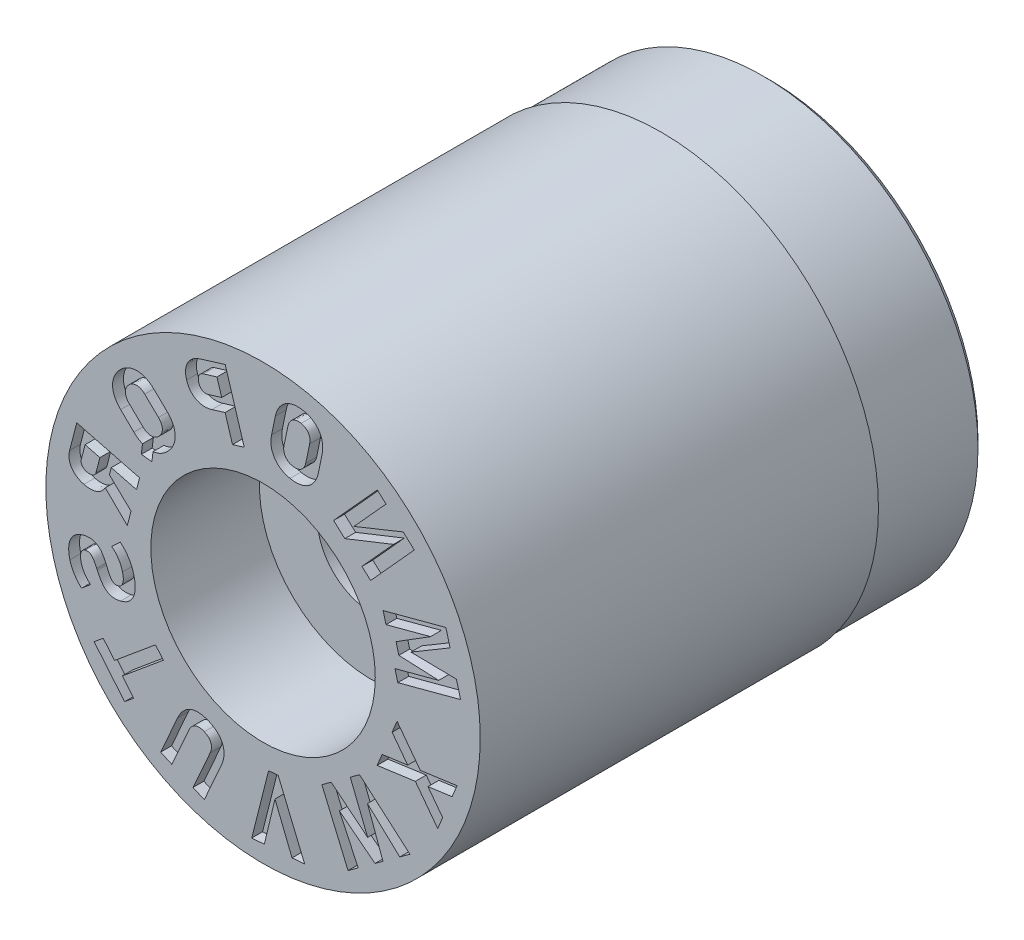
SolidWorks part; units mm, degrees
ref_plane "Front Plane" through (0, 0, 0) normal (0, 0, 1) x (1, 0, 0)
ref_plane "Top Plane" through (0, 0, 0) normal (0, 1, 0) x (1, 0, 0)
ref_plane "Right Plane" through (0, 0, 0) normal (1, 0, 0) x (0, 0, -1)
sketch "Sketch1" plane through (0, 0, 0) normal (1, 0, 0) x (0, 0, -1)
  line L2 (0, 6) -> (0, 3.1)
  line L3 (13.75, 6) -> (0, 6)
  line L4 (-3.7979, 0) -> (49996.2021, 0) construction
  line L8 (14, 1.5) -> (3, 1.5)
  line L9 (3, 3.1) -> (3, 1.5)
  line L10 (3, 3.1) -> (0, 3.1)
  line L12 (14, 1.5) -> (14, 5.75)
  line L16 (14, 5.75) -> (13.75, 6)
  dimension "D1" = 14
  dimension "D2" = 45
  dimension "D3" = 0.25
  dimension "D4" = 12
  dimension "D5" = 6.2
  dimension "D6" = 3
  dimension "D7" = 3
revolve "Revolve1" add sketch "Sketch1" angle 360 about L4
sketch "Sketch4" plane through (0, 0, 0) normal (1, 0, 0) x (0, 0, -1)
  line L0 (0, 0) -> (50000, 0) construction
  line L1 (14, -5.75) -> (14, 5.75) construction
  line L2 (11, 6.935) -> (14, 6.935)
  line L3 (11, 6.935) -> (11, 5.935)
  line L4 (11, 5.935) -> (14, 5.935)
  line L5 (14, 6.935) -> (14, 5.935)
  line L6 (13.75, 6) -> (0, 6) construction
  line L9 (0, 6.6) -> (0, -6.6) construction
  dimension "D1" = 1
  dimension "D2" = 0.065
  dimension "D3" = 11
revolve "Cut-Revolve1" cut sketch "Sketch4" angle 360 about L0
sketch "Sketch5" plane through (0, 0, 0) normal (0, 0, 1) x (1, 0, 0)
  line L0 (5.1654, 1.7444) -> (5.0506, 2.1748)
  line L1 (5.0506, 2.1748) -> (3.3165, 1.7125)
  line L2 (3.3165, 1.7125) -> (3.3958, 1.4158)
  line L3 (3.3958, 1.4158) -> (4.6273, 1.744)
  line L4 (-1.0446, 5.4175) -> (-1.3682, 5.3187)
  line L5 (4.6273, 1.744) -> (3.6742, 1.1476)
  line L6 (3.6742, 1.1476) -> (3.7511, 0.8588)
  line L7 (3.7511, 0.8588) -> (4.8515, 0.8098)
  line L9 (4.8515, 0.8098) -> (3.643, 0.4877)
  line L10 (3.643, 0.4877) -> (3.7221, 0.1908)
  line L11 (3.7221, 0.1908) -> (5.4563, 0.6531)
  line L12 (5.4563, 0.6531) -> (5.3418, 1.0836)
  line L13 (5.3418, 1.0836) -> (4.0848, 1.1025)
  line L14 (4.0848, 1.1025) -> (5.1654, 1.7444)
  line L15 (4.1787, 3.5924) -> (3.8713, 3.8709)
  line L16 (3.8713, 3.8709) -> (2.5124, 3.3232)
  line L18 (2.5124, 3.3232) -> (3.3969, 4.3002)
  line L19 (3.3969, 4.3002) -> (3.1564, 4.5178)
  line L20 (3.1564, 4.5178) -> (1.9495, 3.1846)
  line L21 (1.9495, 3.1846) -> (2.2588, 2.9048)
  line L22 (2.2588, 2.9048) -> (3.6023, 3.4386)
  line L24 (3.6023, 3.4386) -> (2.7316, 2.4768)
  line L25 (2.7316, 2.4768) -> (2.9718, 2.2591)
  line L26 (2.9718, 2.2591) -> (4.1787, 3.5924)
  line L27 (1.5262, 4.1053) -> (1.631, 4.606)
  line L28 (0.3404, 4.8755) -> (0.2356, 4.3748)
  line L29 (0.5792, 4.2943) -> (0.6873, 4.8119)
  line L30 (1.2878, 4.6863) -> (1.1796, 4.1687)
  line L31 (-1.1424, 4.5795) -> (-1.5157, 4.4657)
  line L32 (-1.6462, 4.8931) -> (-1.273, 5.0069)
  line L33 (-1.0472, 4.2678) -> (-0.8439, 3.602)
  line L34 (-1.3682, 5.3187) -> (-1.7332, 5.2073)
  line L35 (-1.4121, 4.1564) -> (-1.0472, 4.2678)
  line L36 (-4.1925, 1.3779) -> (-3.495, 1.197)
  line L37 (-4.1027, -3.1917) -> (-4.4157, -2.8153)
  line L38 (-1.273, 5.0069) -> (-1.1424, 4.5795)
  line L39 (-0.8439, 3.602) -> (-0.5202, 3.7007)
  line L40 (-0.5202, 3.7007) -> (-1.0446, 5.4175)
  line L42 (-3.3297, 2.3797) -> (-3.3625, 2.1101)
  line L43 (-3.3625, 2.1101) -> (-3.0704, 2.0795)
  line L44 (-3.0704, 2.0795) -> (-3.0394, 2.3364)
  line L45 (-2.6491, 3.4882) -> (-3.0167, 3.8444)
  line L46 (-3.9352, 2.8958) -> (-3.5677, 2.5396)
  line L47 (-3.3154, 2.7877) -> (-3.6958, 3.156)
  line L48 (-3.2686, 3.5971) -> (-2.8882, 3.2288)
  line L49 (-4.5074, 1.4596) -> (-4.613, 1.0531)
  line L50 (-5.0209, 1.1591) -> (-4.9154, 1.5654)
  line L53 (-4.2439, 1.1799) -> (-4.1925, 1.3779)
  line L55 (-5.1457, 1.9741) -> (-5.3424, 1.2145)
  line L56 (-4.9154, 1.5654) -> (-4.5074, 1.4596)
  line L57 (-3.495, 1.197) -> (-3.4105, 1.5241)
  line L58 (-3.4105, 1.5241) -> (-5.1457, 1.9741)
  line L60 (-4.3576, 0.8121) -> (-3.7505, 0.2122)
  line L61 (-3.7505, 0.2122) -> (-3.6477, 0.6081)
  line L62 (-3.6477, 0.6081) -> (-4.2439, 1.1799)
  line L63 (-3.9475, -0.2813) -> (-4.1817, -0.5018)
  line L64 (-4.007, -1.3562) -> (-4.0085, -1.3565)
  line L65 (-4.2963, -1.0879) -> (-4.3065, -1.0626)
  line L66 (-4.9585, -0.6215) -> (-4.96, -0.6219)
  line L67 (-5.0124, -1.9173) -> (-4.768, -1.708)
  line L68 (-4.9093, -0.9572) -> (-4.9081, -0.957)
  line L69 (-3.9338, -1.6853) -> (-3.9317, -1.6846)
  line L71 (-3.8861, -3.4523) -> (-2.7544, -2.5113)
  line L72 (-2.7544, -2.5113) -> (-2.9711, -2.2507)
  line L73 (-2.9711, -2.2507) -> (-4.1027, -3.1917)
  line L74 (-4.6665, -3.0237) -> (-3.8238, -4.0373)
  line L75 (-3.8238, -4.0373) -> (-3.573, -3.8289)
  line L76 (-3.573, -3.8289) -> (-3.8861, -3.4523)
  line L77 (-4.4157, -2.8153) -> (-4.6665, -3.0237)
  line L78 (-2.3599, -3.694) -> (-2.829, -4.747)
  line L79 (-2.829, -4.747) -> (-2.5181, -4.8857)
  line L80 (-2.5181, -4.8857) -> (-2.0455, -3.8251)
  line L81 (-1.4622, -4.0848) -> (-1.9349, -5.1454)
  line L82 (-1.9349, -5.1454) -> (-1.6237, -5.2839)
  line L83 (-1.6237, -5.2839) -> (-1.1546, -4.2308)
  line L84 (-0.3134, -5.5446) -> (0.0358, -5.5187)
  line L85 (0.0358, -5.5187) -> (0.3298, -4.2898)
  line L86 (0.3298, -4.2898) -> (0.8007, -5.4626)
  line L87 (0.8007, -5.4626) -> (1.15, -5.4368)
  line L88 (1.15, -5.4368) -> (0.4187, -3.6808)
  line L89 (0.4187, -3.6808) -> (0.1534, -3.7001)
  line L90 (0.1534, -3.7001) -> (-0.3134, -5.5446)
  line L91 (3.093, -4.4494) -> (3.3124, -4.2895)
  line L92 (3.3124, -4.2895) -> (2.8847, -3.1197)
  line L93 (2.8847, -3.1197) -> (3.7763, -3.9516)
  line L94 (3.7763, -3.9516) -> (4.0577, -3.7465)
  line L95 (4.0577, -3.7465) -> (2.6667, -2.5395)
  line L96 (2.6667, -2.5395) -> (2.4092, -2.7268)
  line L97 (2.4092, -2.7268) -> (2.89, -3.9279)
  line L98 (2.89, -3.9279) -> (1.8824, -3.1107)
  line L99 (1.8824, -3.1107) -> (1.6252, -3.2982)
  line L100 (1.6252, -3.2982) -> (2.3478, -4.9924)
  line L101 (2.3478, -4.9924) -> (2.6291, -4.7873)
  line L102 (2.6291, -4.7873) -> (2.1104, -3.6838)
  line L103 (2.1104, -3.6838) -> (3.093, -4.4494)
  line L105 (4.2076, -1.9277) -> (4.8249, -2.7493)
  line L106 (4.8249, -2.7493) -> (4.9619, -2.418)
  line L107 (4.9619, -2.418) -> (4.5565, -1.8793)
  line L109 (4.3437, -1.5968) -> (3.7022, -0.7417)
  line L110 (3.7022, -0.7417) -> (3.5655, -1.0733)
  line L111 (3.5655, -1.0733) -> (3.9952, -1.6451)
  line L112 (4.5565, -1.8793) -> (5.2224, -1.7875)
  line L113 (5.2224, -1.7875) -> (5.3597, -1.4559)
  line L114 (5.3597, -1.4559) -> (4.3437, -1.5968)
  line L115 (3.9952, -1.6451) -> (3.2887, -1.743)
  line L116 (3.2887, -1.743) -> (3.1517, -2.0743)
  line L117 (3.1517, -2.0743) -> (4.2076, -1.9277)
  circle A0 centre (0, 0) radius 3.7731 construction
  spline S0 degree 3 poles (0.7447, 3.5886) (0.7759, 3.5826) (0.8224, 3.5747) (0.8845, 3.5709) (0.9294, 3.571) (0.9735, 3.5732) (1.0167, 3.5788) (1.059, 3.5872) (1.1003, 3.5984) (1.1403, 3.612) (1.1787, 3.6286) (1.2156, 3.6473) (1.2506, 3.6691) (1.2844, 3.6927) (1.3163, 3.7193) (1.3468, 3.7482) (1.3752, 3.7798) (1.402, 3.8133) (1.4265, 3.8492) (1.4485, 3.8872) (1.4688, 3.9268) (1.4866, 3.9686) (1.5073, 4.0277) (1.5199, 4.0737) (1.5262, 4.1053) knots 0 0 0 0 0.090309 0.133955 0.17644 0.218092 0.259396 0.30008 0.340623 0.380716 0.420299 0.459324 0.498272 0.537251 0.576572 0.616137 0.656469 0.6971 0.738132 0.779773 0.821894 0.864642 0.908542 1 1 1 1
  spline S1 degree 3 poles (1.631, 4.606) (1.6372, 4.6375) (1.6452, 4.6845) (1.6492, 4.7472) (1.6495, 4.7926) (1.6474, 4.8372) (1.6419, 4.8806) (1.6341, 4.9233) (1.6229, 4.9647) (1.6094, 5.005) (1.5935, 5.0439) (1.5748, 5.081) (1.5533, 5.1162) (1.5299, 5.15) (1.5035, 5.1818) (1.475, 5.2124) (1.4437, 5.2408) (1.4104, 5.2674) (1.3751, 5.2921) (1.3376, 5.3145) (1.2982, 5.3344) (1.257, 5.3525) (1.1986, 5.3736) (1.1529, 5.3854) (1.1218, 5.3918) knots 0 0 0 0 0.091337 0.135318 0.17845 0.220422 0.262032 0.302814 0.343637 0.383994 0.423573 0.462827 0.501982 0.540672 0.579691 0.6194 0.659411 0.699714 0.74048 0.781827 0.823609 0.866016 0.909555 1 1 1 1
  spline S2 degree 3 poles (1.1218, 5.3918) (1.0907, 5.3987) (1.0441, 5.4053) (0.9822, 5.4098) (0.9374, 5.4098) (0.8933, 5.4073) (0.8502, 5.4018) (0.8079, 5.3933) (0.7667, 5.3822) (0.7266, 5.3685) (0.6882, 5.3521) (0.6514, 5.3331) (0.6159, 5.3123) (0.5827, 5.2877) (0.5505, 5.2614) (0.5202, 5.2324) (0.4918, 5.2008) (0.4649, 5.1673) (0.4406, 5.1313) (0.418, 5.0937) (0.3979, 5.054) (0.38, 5.0123) (0.3593, 4.953) (0.3467, 4.907) (0.3404, 4.8755) knots 0 0 0 0 0.090358 0.133573 0.176392 0.217748 0.259065 0.299764 0.340321 0.380426 0.420023 0.459061 0.497939 0.537051 0.576386 0.615964 0.656311 0.696955 0.738001 0.779698 0.821486 0.864596 0.908511 1 1 1 1
  spline S3 degree 3 poles (0.2356, 4.3748) (0.2294, 4.3433) (0.2213, 4.2963) (0.2174, 4.2336) (0.217, 4.1881) (0.2198, 4.1436) (0.2245, 4.1) (0.233, 4.0574) (0.244, 4.0159) (0.2574, 3.9756) (0.2737, 3.937) (0.2923, 3.9001) (0.3134, 3.8646) (0.3374, 3.8311) (0.3631, 3.7987) (0.3923, 3.7686) (0.4231, 3.7397) (0.4566, 3.7133) (0.4918, 3.6885) (0.5292, 3.6662) (0.5686, 3.6463) (0.6097, 3.6282) (0.6681, 3.6072) (0.7136, 3.5954) (0.7447, 3.5886) knots 0 0 0 0 0.091366 0.135362 0.178507 0.220649 0.262097 0.303088 0.343924 0.384295 0.423646 0.462912 0.501797 0.540796 0.579987 0.619572 0.65971 0.700026 0.740805 0.782165 0.823614 0.866382 0.909588 1 1 1 1
  spline S4 degree 3 poles (0.8146, 3.9216) (0.7863, 3.9278) (0.7451, 3.9403) (0.6964, 3.9679) (0.6641, 3.9918) (0.6366, 4.02) (0.613, 4.0512) (0.5949, 4.086) (0.5812, 4.1237) (0.5729, 4.1638) (0.568, 4.2212) (0.5732, 4.2651) (0.5792, 4.2943) knots 0 0 0 0 0.175337 0.256981 0.337413 0.416956 0.494362 0.572678 0.653127 0.735718 0.819651 1 1 1 1
  spline S5 degree 3 poles (0.6873, 4.8119) (0.694, 4.8408) (0.7058, 4.8835) (0.7338, 4.9338) (0.7573, 4.9674) (0.7849, 4.9963) (0.8156, 5.0207) (0.8494, 5.0403) (0.8862, 5.0545) (0.9252, 5.064) (0.9811, 5.0692) (1.0238, 5.0648) (1.0522, 5.0587) knots 0 0 0 0 0.179938 0.264469 0.346756 0.426904 0.50555 0.582668 0.66206 0.742723 0.824728 1 1 1 1
  spline S6 degree 3 poles (1.0522, 5.0587) (1.0807, 5.0529) (1.1218, 5.0401) (1.1709, 5.0128) (1.2027, 4.9883) (1.2305, 4.9606) (1.2539, 4.9294) (1.2721, 4.8946) (1.2858, 4.8569) (1.294, 4.8168) (1.2989, 4.7594) (1.2937, 4.7155) (1.2878, 4.6863) knots 0 0 0 0 0.175431 0.257806 0.338407 0.416987 0.494388 0.5727 0.653145 0.735732 0.819661 1 1 1 1
  spline S7 degree 3 poles (1.1796, 4.1687) (1.1734, 4.1396) (1.1603, 4.0975) (1.1333, 4.0467) (1.1096, 4.0133) (1.0821, 3.9843) (1.0512, 3.9602) (1.0177, 3.9404) (0.981, 3.9259) (0.9419, 3.9164) (0.8859, 3.9116) (0.843, 3.9156) (0.8146, 3.9216) knots 0 0 0 0 0.179869 0.264322 0.346594 0.426726 0.504705 0.582404 0.66126 0.741908 0.824543 1 1 1 1
  spline S8 degree 3 poles (-1.5157, 4.4657) (-1.534, 4.4604) (-1.5619, 4.4545) (-1.5992, 4.4557) (-1.6259, 4.4604) (-1.6514, 4.4686) (-1.6753, 4.481) (-1.6976, 4.4962) (-1.7182, 4.5149) (-1.7368, 4.5367) (-1.7589, 4.5703) (-1.7699, 4.5991) (-1.7763, 4.6187) knots 0 0 0 0 0.169096 0.248837 0.328291 0.407592 0.485444 0.56448 0.645699 0.730517 0.816943 1 1 1 1
  spline S9 degree 3 poles (-1.7763, 4.6187) (-1.7821, 4.6388) (-1.7891, 4.6692) (-1.7897, 4.7097) (-1.7868, 4.7383) (-1.7809, 4.7656) (-1.771, 4.7909) (-1.7582, 4.8145) (-1.7413, 4.8353) (-1.7221, 4.8543) (-1.6913, 4.8761) (-1.6647, 4.8872) (-1.6462, 4.8931) knots 0 0 0 0 0.184004 0.27093 0.354752 0.435986 0.514589 0.592825 0.670551 0.749073 0.829595 1 1 1 1
  spline S10 degree 3 poles (-1.7332, 5.2073) (-1.784, 5.1922) (-1.8563, 5.1617) (-1.9416, 5.1052) (-1.9965, 5.0571) (-2.0436, 5.0033) (-2.0816, 4.9443) (-2.1111, 4.8807) (-2.1306, 4.8127) (-2.1414, 4.7415) (-2.1424, 4.6412) (-2.1268, 4.5659) (-2.112, 4.5163) knots 0 0 0 0 0.179249 0.263208 0.345337 0.425394 0.504137 0.58209 0.661679 0.742471 0.824841 1 1 1 1
  spline S11 degree 3 poles (-2.112, 4.5163) (-2.0969, 4.4667) (-2.0669, 4.3958) (-2.0102, 4.3129) (-1.9615, 4.26) (-1.9074, 4.2147) (-1.8477, 4.1786) (-1.7831, 4.1513) (-1.7142, 4.1333) (-1.6419, 4.1243) (-1.5396, 4.1253) (-1.4627, 4.1409) (-1.4121, 4.1564) knots 0 0 0 0 0.175848 0.258225 0.33901 0.418386 0.496357 0.574428 0.654799 0.736649 0.820571 1 1 1 1
  spline S12 degree 3 poles (-2.6292, 2.5504) (-2.607, 2.5733) (-2.5762, 2.609) (-2.5393, 2.6589) (-2.5152, 2.6969) (-2.4942, 2.7359) (-2.4755, 2.7753) (-2.46, 2.8156) (-2.4473, 2.8565) (-2.4379, 2.8977) (-2.4308, 2.9389) (-2.4278, 2.9802) (-2.4266, 3.0215) (-2.4293, 3.0628) (-2.4347, 3.1041) (-2.4431, 3.1452) (-2.4544, 3.1863) (-2.4685, 3.2269) (-2.4857, 3.2668) (-2.5058, 3.3059) (-2.5288, 3.3441) (-2.5547, 3.3813) (-2.5932, 3.431) (-2.626, 3.4658) (-2.6491, 3.4882) knots 0 0 0 0 0.090426 0.133689 0.176148 0.218001 0.259295 0.300043 0.340441 0.380689 0.419969 0.459108 0.498041 0.53728 0.576345 0.61612 0.656449 0.697181 0.738178 0.779637 0.821748 0.864691 0.908434 1 1 1 1
  spline S13 degree 3 poles (-3.0167, 3.8444) (-3.0395, 3.8672) (-3.0759, 3.8982) (-3.1267, 3.9352) (-3.1648, 3.9602) (-3.204, 3.9816) (-3.2435, 4.0006) (-3.2839, 4.0166) (-3.325, 4.0294) (-3.3664, 4.0395) (-3.4078, 4.0465) (-3.4493, 4.0509) (-3.4906, 4.0514) (-3.5319, 4.0499) (-3.5731, 4.0446) (-3.6142, 4.0368) (-3.655, 4.0258) (-3.6954, 4.012) (-3.735, 3.9948) (-3.7739, 3.9751) (-3.8119, 3.9525) (-3.8492, 3.9274) (-3.8978, 3.8887) (-3.9329, 3.8572) (-3.9548, 3.834) knots 0 0 0 0 0.091403 0.135417 0.178547 0.220567 0.262012 0.302889 0.34372 0.384051 0.423731 0.462948 0.50222 0.541091 0.580115 0.619826 0.659729 0.700018 0.741007 0.781995 0.823929 0.866198 0.909652 1 1 1 1
  spline S14 degree 3 poles (-3.9548, 3.834) (-3.977, 3.8112) (-4.0077, 3.7754) (-4.0448, 3.7255) (-4.0686, 3.6873) (-4.0899, 3.6485) (-4.1084, 3.6091) (-4.124, 3.5688) (-4.1367, 3.528) (-4.146, 3.4867) (-4.1536, 3.4455) (-4.1565, 3.4041) (-4.1578, 3.3628) (-4.1549, 3.3215) (-4.1503, 3.2803) (-4.1411, 3.2392) (-4.13, 3.1981) (-4.1158, 3.1575) (-4.0987, 3.1176) (-4.0784, 3.0785) (-4.0557, 3.04) (-4.0296, 3.0027) (-3.9912, 2.953) (-3.9584, 2.9183) (-3.9352, 2.8958) knots 0 0 0 0 0.090391 0.133637 0.176367 0.217904 0.259183 0.299915 0.340297 0.38053 0.419864 0.458987 0.498252 0.537129 0.576146 0.615965 0.656278 0.696994 0.737976 0.779419 0.821817 0.864744 0.90847 1 1 1 1
  spline S15 degree 3 poles (-3.5677, 2.5396) (-3.5449, 2.5169) (-3.5085, 2.4858) (-3.4576, 2.449) (-3.4198, 2.4237) (-3.3805, 2.4025) (-3.3503, 2.3884) (-3.3333, 2.3812) (-3.3297, 2.3797) knots 0 0 0 0 0.091394 0.135404 0.178246 0.220561 0.261843 0.272833 0.272833 0.272833 0.272833
  spline S16 degree 3 poles (-2.8738, 2.7874) (-2.894, 2.7663) (-2.927, 2.7387) (-2.9766, 2.7119) (-3.0142, 2.6979) (-3.0527, 2.6891) (-3.0918, 2.6863) (-3.1309, 2.6895) (-3.1699, 2.6983) (-3.2086, 2.7123) (-3.2593, 2.7398) (-3.2941, 2.7668) (-3.3154, 2.7877) knots 0 0 0 0 0.175986 0.257432 0.338339 0.41715 0.495361 0.573284 0.653221 0.73592 0.820149 1 1 1 1
  spline S17 degree 3 poles (-3.6958, 3.156) (-3.7171, 3.177) (-3.7459, 3.2105) (-3.7746, 3.2606) (-3.7896, 3.2987) (-3.8, 3.3373) (-3.8043, 3.3763) (-3.8027, 3.4153) (-3.7949, 3.454) (-3.7824, 3.4923) (-3.7565, 3.5423) (-3.7299, 3.5761) (-3.7098, 3.5971) knots 0 0 0 0 0.180529 0.264653 0.347008 0.427165 0.50483 0.582495 0.661932 0.742211 0.824735 1 1 1 1
  spline S18 degree 3 poles (-3.7098, 3.5971) (-3.6899, 3.6183) (-3.6566, 3.6452) (-3.6075, 3.6726) (-3.5698, 3.6865) (-3.5314, 3.6954) (-3.4924, 3.698) (-3.4532, 3.6954) (-3.4141, 3.6866) (-3.3758, 3.6722) (-3.3244, 3.6459) (-3.2902, 3.6177) (-3.2686, 3.5971) knots 0 0 0 0 0.175091 0.256927 0.337894 0.416762 0.494294 0.572927 0.652923 0.734998 0.819566 1 1 1 1
  spline S19 degree 3 poles (-2.8882, 3.2288) (-2.8668, 3.2081) (-2.8381, 3.1746) (-2.8094, 3.1246) (-2.7942, 3.0864) (-2.7845, 3.0475) (-2.78, 3.0083) (-2.7818, 2.9692) (-2.789, 2.9304) (-2.8016, 2.8921) (-2.8276, 2.8424) (-2.8531, 2.8078) (-2.8738, 2.7874) knots 0 0 0 0 0.179935 0.264042 0.346381 0.427082 0.505467 0.583116 0.662376 0.742638 0.825146 1 1 1 1
  spline S20 degree 3 poles (-4.613, 1.0531) (-4.6174, 1.0374) (-4.6255, 1.0143) (-4.6443, 0.9883) (-4.6606, 0.9713) (-4.6791, 0.9568) (-4.7001, 0.9453) (-4.7229, 0.9362) (-4.7479, 0.9307) (-4.7745, 0.9278) (-4.8126, 0.9277) (-4.8414, 0.9328) (-4.8608, 0.9371) knots 0 0 0 0 0.159483 0.236468 0.311878 0.3885 0.46582 0.544822 0.628637 0.715237 0.805714 1 1 1 1
  spline S21 degree 3 poles (-4.8608, 0.9371) (-4.8802, 0.9417) (-4.9075, 0.9517) (-4.9411, 0.9694) (-4.9626, 0.9851) (-4.9821, 1.0017) (-4.9976, 1.0207) (-5.0105, 1.041) (-5.0194, 1.0628) (-5.0256, 1.0856) (-5.0281, 1.1181) (-5.0255, 1.1428) (-5.0209, 1.1591) knots 0 0 0 0 0.19339 0.282662 0.368882 0.451761 0.530888 0.607069 0.684211 0.759973 0.836229 1 1 1 1
  spline S22 degree 3 poles (-5.3424, 1.2145) (-5.3543, 1.1693) (-5.3642, 1.1007) (-5.3589, 1.0102) (-5.3452, 0.9462) (-5.3229, 0.8856) (-5.292, 0.8289) (-5.253, 0.7767) (-5.2057, 0.7295) (-5.1514, 0.6874) (-5.0672, 0.6386) (-4.9971, 0.6128) (-4.948, 0.6006) knots 0 0 0 0 0.170567 0.250705 0.330137 0.408355 0.486027 0.564778 0.645617 0.729164 0.815362 1 1 1 1
  spline S23 degree 3 poles (-4.948, 0.6006) (-4.8993, 0.588) (-4.8257, 0.5753) (-4.7287, 0.5778) (-4.6606, 0.5877) (-4.5964, 0.6061) (-4.5368, 0.6328) (-4.4822, 0.6675) (-4.4333, 0.7103) (-4.391, 0.7585) (-4.3678, 0.7941) (-4.3576, 0.8121) knots 0 0 0 0 0.184092 0.270177 0.353603 0.434757 0.513264 0.591389 0.670213 0.749653 0.825011 0.825011 0.825011 0.825011
  spline S24 degree 3 poles (-3.5671, -0.8858) (-3.5776, -0.8446) (-3.5956, -0.7832) (-3.6273, -0.7045) (-3.6531, -0.647) (-3.6818, -0.5916) (-3.7128, -0.5385) (-3.7467, -0.4881) (-3.7829, -0.4403) (-3.8212, -0.3957) (-3.874, -0.3405) (-3.9172, -0.3035) (-3.9475, -0.2813) knots 0 0 0 0 0.175644 0.262832 0.349669 0.435327 0.519542 0.603115 0.685284 0.766329 0.845433 1 1 1 1
  spline S25 degree 3 poles (-4.1817, -0.5018) (-4.1453, -0.5287) (-4.0947, -0.575) (-4.0352, -0.6453) (-3.9946, -0.7033) (-3.9582, -0.7646) (-3.9164, -0.8503) (-3.894, -0.9184) (-3.8821, -0.9645) knots 0 0 0 0 0.24138 0.364999 0.491375 0.618869 0.745657 1 1 1 1
  spline S26 degree 3 poles (-3.8821, -0.9645) (-3.876, -0.9899) (-3.8679, -1.0272) (-3.8621, -1.0763) (-3.8594, -1.1102) (-3.8602, -1.1424) (-3.8624, -1.1727) (-3.8673, -1.2012) (-3.8743, -1.2278) (-3.8833, -1.2524) (-3.8947, -1.2746) (-3.9082, -1.2945) (-3.9236, -1.3121) (-3.9415, -1.3269) (-3.9687, -1.3435) (-3.9913, -1.3521) (-4.007, -1.3562) knots 0 0 0 0 0.170587 0.248328 0.322569 0.391806 0.45816 0.52068 0.580488 0.636971 0.691385 0.742745 0.792954 0.843465 0.8938 1 1 1 1
  spline S27 degree 3 poles (-4.0085, -1.3565) (-4.0296, -1.3622) (-4.0616, -1.365) (-4.1025, -1.3573) (-4.1294, -1.3449) (-4.1538, -1.3278) (-4.1764, -1.3072) (-4.1971, -1.2831) (-4.2161, -1.2551) (-4.2336, -1.2226) (-4.2598, -1.1714) (-4.2782, -1.1299) (-4.2908, -1.1007) knots 0 0 0 0 0.155114 0.225021 0.294521 0.364238 0.436403 0.511397 0.59025 0.676475 0.774019 1 1 1 1
  spline S28 degree 3 poles (-4.2908, -1.1007) (-4.2917, -1.0986) (-4.2934, -1.0943) (-4.295, -1.0899) (-4.2963, -1.0879) knots 0 0 0 0 0.500653 1 1 1 1
  spline S29 degree 3 poles (-4.3065, -1.0626) (-4.3283, -1.0107) (-4.3624, -0.9374) (-4.4112, -0.8467) (-4.4468, -0.7892) (-4.4854, -0.738) (-4.5315, -0.6946) (-4.5841, -0.6575) (-4.6329, -0.6321) (-4.6754, -0.616) (-4.7099, -0.6073) (-4.7463, -0.6012) (-4.7848, -0.5989) (-4.8254, -0.5996) (-4.8839, -0.6054) (-4.9285, -0.6139) (-4.9585, -0.6215) knots 0 0 0 0 0.19047 0.273753 0.348938 0.419574 0.490325 0.562218 0.637266 0.676009 0.715892 0.757574 0.800922 0.846505 0.89498 1 1 1 1
  spline S30 degree 3 poles (-4.96, -0.6219) (-4.9873, -0.6285) (-5.027, -0.6412) (-5.0772, -0.6622) (-5.1123, -0.6795) (-5.1453, -0.6991) (-5.176, -0.7209) (-5.2047, -0.7444) (-5.2313, -0.7697) (-5.2554, -0.7972) (-5.2772, -0.8264) (-5.2975, -0.8568) (-5.3142, -0.8895) (-5.3295, -0.9235) (-5.3419, -0.9595) (-5.3524, -0.997) (-5.3602, -1.0362) (-5.3654, -1.077) (-5.369, -1.1191) (-5.3694, -1.1627) (-5.3674, -1.2078) (-5.3631, -1.2541) (-5.3541, -1.319) (-5.3437, -1.3679) (-5.3356, -1.4008) knots 0 0 0 0 0.086007 0.12694 0.166595 0.205532 0.243984 0.281754 0.319047 0.356206 0.393347 0.430504 0.467637 0.505717 0.544356 0.584034 0.624686 0.666506 0.709556 0.753906 0.799904 0.84734 0.896318 1 1 1 1
  spline S31 degree 3 poles (-5.3356, -1.4008) (-5.3272, -1.4324) (-5.3132, -1.48) (-5.2878, -1.5414) (-5.2595, -1.6037) (-5.2163, -1.6788) (-5.1373, -1.7941) (-5.0649, -1.8709) (-5.0124, -1.9173) knots 0 0 0 0 0.158912 0.240043 0.322666 0.490655 0.659732 1 1 1 1
  spline S32 degree 3 poles (-4.768, -1.708) (-4.7989, -1.6805) (-4.8432, -1.6371) (-4.8947, -1.5734) (-4.9295, -1.5245) (-4.96, -1.4746) (-4.993, -1.4083) (-5.0114, -1.3569) (-5.0201, -1.3223) knots 0 0 0 0 0.265982 0.396334 0.525301 0.651055 0.771158 1 1 1 1
  spline S33 degree 3 poles (-5.0201, -1.3223) (-5.026, -1.2984) (-5.0336, -1.2633) (-5.039, -1.2171) (-5.0419, -1.1852) (-5.0414, -1.155) (-5.0397, -1.1267) (-5.0358, -1.1) (-5.0296, -1.0753) (-5.0214, -1.0524) (-5.011, -1.0319) (-4.999, -1.0136) (-4.9846, -0.9977) (-4.9689, -0.9836) (-4.9441, -0.9686) (-4.9238, -0.9603) (-4.9093, -0.9572) knots 0 0 0 0 0.173025 0.252201 0.327257 0.39764 0.464425 0.526485 0.586732 0.643338 0.696996 0.74776 0.797256 0.84667 0.895785 1 1 1 1
  spline S34 degree 3 poles (-4.9081, -0.957) (-4.8852, -0.9518) (-4.8503, -0.9468) (-4.806, -0.956) (-4.777, -0.9696) (-4.7512, -0.988) (-4.7266, -1.0089) (-4.7054, -1.0339) (-4.6856, -1.0625) (-4.6661, -1.0959) (-4.636, -1.1516) (-4.6141, -1.1975) (-4.5985, -1.2299) knots 0 0 0 0 0.156351 0.226805 0.295873 0.365882 0.435858 0.507883 0.58184 0.665041 0.762672 1 1 1 1
  spline S35 degree 3 poles (-4.5985, -1.2299) (-4.5964, -1.2326) (-4.5949, -1.2392) (-4.5916, -1.2452) (-4.59, -1.2482) knots 0 0 0 0 0.492003 1 1 1 1
  spline S36 degree 3 poles (-4.59, -1.2482) (-4.5881, -1.2527) (-4.5835, -1.2613) (-4.5788, -1.2699) (-4.5769, -1.2745) knots 0 0 0 0 0.499993 1 1 1 1
  spline S37 degree 3 poles (-4.5769, -1.2745) (-4.5544, -1.3232) (-4.5191, -1.3923) (-4.4679, -1.4772) (-4.4307, -1.5318) (-4.3901, -1.5797) (-4.3436, -1.6204) (-4.2913, -1.6545) (-4.2436, -1.6779) (-4.2023, -1.692) (-4.169, -1.6999) (-4.134, -1.7048) (-4.0972, -1.7071) (-4.0588, -1.7059) (-4.0037, -1.7008) (-3.9621, -1.6919) (-3.9338, -1.6853) knots 0 0 0 0 0.189359 0.273145 0.349573 0.422066 0.493982 0.566732 0.641676 0.680723 0.720434 0.762091 0.805057 0.850373 0.897539 1 1 1 1
  spline S38 degree 3 poles (-3.9317, -1.6846) (-3.9048, -1.6779) (-3.8654, -1.6661) (-3.8158, -1.6446) (-3.781, -1.6273) (-3.749, -1.6069) (-3.7183, -1.5857) (-3.6906, -1.5614) (-3.6643, -1.5356) (-3.6406, -1.5076) (-3.6192, -1.4777) (-3.5998, -1.4463) (-3.5828, -1.4131) (-3.5686, -1.3778) (-3.5569, -1.3408) (-3.5469, -1.3021) (-3.5394, -1.2616) (-3.5345, -1.2195) (-3.5317, -1.1759) (-3.5318, -1.131) (-3.5332, -1.0845) (-3.5387, -1.0368) (-3.5479, -0.9701) (-3.5588, -0.9198) (-3.5671, -0.8858) knots 0 0 0 0 0.083718 0.12368 0.162774 0.200841 0.238026 0.275062 0.312041 0.348948 0.385557 0.422743 0.460081 0.49804 0.537154 0.577089 0.618552 0.661206 0.704906 0.75011 0.796783 0.84492 0.894727 1 1 1 1
  spline S39 degree 3 poles (-1.4848, -3.3485) (-1.5156, -3.335) (-1.5617, -3.3168) (-1.624, -3.2983) (-1.6692, -3.2876) (-1.7137, -3.2797) (-1.7575, -3.275) (-1.8005, -3.2736) (-1.8427, -3.2749) (-1.8838, -3.2795) (-1.9241, -3.2868) (-1.9633, -3.2968) (-2.0012, -3.3103) (-2.0382, -3.3266) (-2.0739, -3.3461) (-2.1086, -3.3683) (-2.142, -3.3935) (-2.1742, -3.4216) (-2.2051, -3.4524) (-2.2346, -3.4859) (-2.2626, -3.5221) (-2.2895, -3.561) (-2.3231, -3.6179) (-2.3464, -3.6626) (-2.3599, -3.694) knots 0 0 0 0 0.094156 0.138779 0.182139 0.22438 0.265402 0.305403 0.344817 0.38363 0.421492 0.459363 0.496859 0.534366 0.572445 0.610654 0.649882 0.689652 0.730496 0.77191 0.814743 0.858808 0.904349 1 1 1 1
  spline S40 degree 3 poles (-2.0455, -3.8251) (-2.036, -3.8025) (-2.0187, -3.7709) (-1.992, -3.7325) (-1.9709, -3.7074) (-1.9483, -3.6855) (-1.9241, -3.6668) (-1.8987, -3.6506) (-1.8715, -3.6382) (-1.8434, -3.6285) (-1.8141, -3.6228) (-1.784, -3.6194) (-1.753, -3.6198) (-1.7212, -3.6239) (-1.6767, -3.6345) (-1.6435, -3.6459) (-1.6218, -3.6559) knots 0 0 0 0 0.141487 0.207519 0.270314 0.330451 0.389288 0.446711 0.504412 0.561416 0.618774 0.676475 0.736022 0.797681 0.861628 1 1 1 1
  spline S41 degree 3 poles (-1.6218, -3.6559) (-1.5997, -3.6654) (-1.5687, -3.6824) (-1.5311, -3.7088) (-1.5066, -3.7297) (-1.4855, -3.7527) (-1.4676, -3.7772) (-1.452, -3.8029) (-1.4404, -3.8305) (-1.4313, -3.859) (-1.4259, -3.8888) (-1.424, -3.9193) (-1.4247, -3.9507) (-1.4293, -3.9831) (-1.4394, -4.0287) (-1.4523, -4.0624) (-1.4622, -4.0848) knots 0 0 0 0 0.138615 0.202931 0.264759 0.323989 0.382078 0.4396 0.496901 0.554319 0.612241 0.670493 0.730837 0.792858 0.858592 1 1 1 1
  spline S42 degree 3 poles (-1.1546, -4.2308) (-1.141, -4.1995) (-1.1217, -4.1528) (-1.1029, -4.0894) (-1.092, -4.0435) (-1.0835, -3.9985) (-1.0781, -3.9541) (-1.0766, -3.9106) (-1.0772, -3.8678) (-1.0814, -3.8261) (-1.0881, -3.7854) (-1.0975, -3.7457) (-1.1105, -3.7074) (-1.126, -3.6701) (-1.1447, -3.6342) (-1.1661, -3.5992) (-1.1905, -3.5656) (-1.2178, -3.5332) (-1.2477, -3.5021) (-1.2807, -3.4728) (-1.3163, -3.4448) (-1.3544, -3.4184) (-1.4099, -3.3845) (-1.4541, -3.362) (-1.4848, -3.3485) knots 0 0 0 0 0.095734 0.141071 0.185142 0.227879 0.269369 0.31005 0.349865 0.389039 0.427225 0.465376 0.5031 0.540461 0.578334 0.616281 0.655193 0.694595 0.734682 0.776013 0.818065 0.861338 0.905977 1 1 1 1
  spline S43 degree 3 poles (-3.0394, 2.3364) (-3.0301, 2.3374) (-3.007, 2.3405) (-2.9704, 2.3482) (-2.9294, 2.359) (-2.8888, 2.3727) (-2.8491, 2.3897) (-2.8102, 2.4092) (-2.7724, 2.4321) (-2.7348, 2.4569) (-2.6863, 2.4958) (-2.651, 2.5272) (-2.6292, 2.5504) knots 0.553404 0.553404 0.553404 0.553404 0.579915 0.619336 0.659574 0.700191 0.740727 0.782026 0.823652 0.866211 0.90966 1 1 1 1
  dimension "D1" = 7.5461
extrude "Cut-Extrude1" cut sketch "Sketch5" against normal blind 0.3
